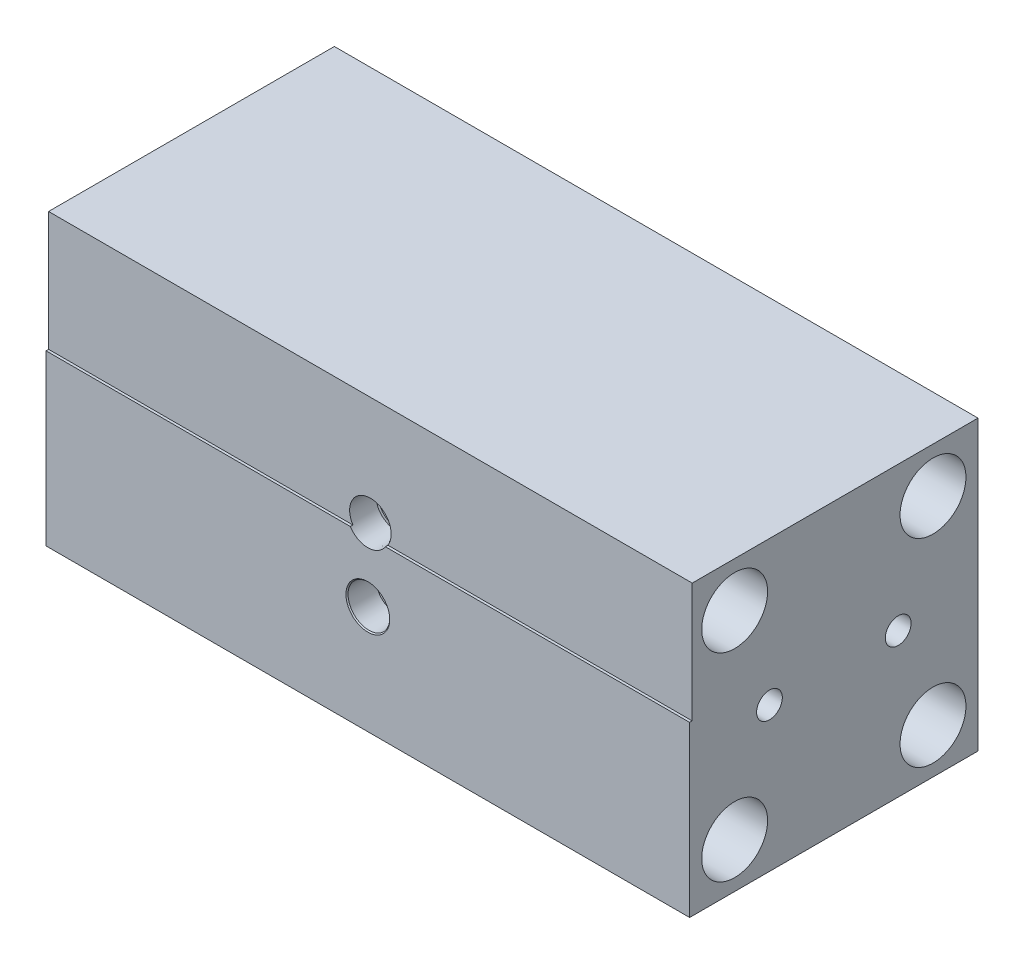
SolidWorks part; units mm, degrees
ref_plane "Front Plane" through (0, 0, 0) normal (0, 0, 1) x (1, 0, 0)
ref_plane "Top Plane" through (0, 0, 0) normal (0, 1, 0) x (1, 0, 0)
ref_plane "Right Plane" through (0, 0, 0) normal (1, 0, 0) x (0, 0, -1)
sketch "Sketch1" plane through (0, 0, 0) normal (0, 0, 1) x (1, 0, 0)
  line L0 (-79.375, -35.56) -> (79.375, -35.56)
  line L1 (79.375, -35.56) -> (79.375, 35.56)
  line L2 (79.375, 35.56) -> (-79.375, 35.56)
  line L3 (-79.375, 35.56) -> (-79.375, -35.56)
  line L4 (-79.375, 35.56) -> (79.375, -35.56) construction
  dimension "D1" = 158.75
  dimension "D2" = 71.12
extrude "Extrude1" add sketch "Sketch1" along normal mid plane 71.12
sketch "Sketch18" plane through (79.375, 0, 0) normal (1, 0, 0) x (0, 0, -1)
  line L0 (-35.56, 35.56) -> (-35.56, 6.1214)
  line L1 (-35.56, 6.1214) -> (-34.925, 6.1214)
  line L2 (-34.925, 6.1214) -> (-34.925, 35.56)
  line L3 (-34.925, 35.56) -> (-35.56, 35.56)
  line L4 (-35.56, 35.56) -> (35.56, 35.56) construction
  line L5 (-35.56, -35.56) -> (-35.56, 35.56) construction
  dimension "D1" = 29.4386
  dimension "D2" = 0.635
  dimension "D3" = 34.925
extrude "Cut-Extrude1" cut sketch "Sketch18" against normal through all
hole_wizard "1/4-20 Tapped Hole1" positions "Sketch20" profile "Sketch19" tap size "1/4-20" standard "ANSI Inch"
sketch "Sketch20" plane through (0.5389, -35.56, 6.9814) normal (0, 1, 0) x (1, 0, 0)
  line L1 (-57.6889, 6.9814) -> (-19.5889, 6.9814) construction
  line L2 (-19.5889, 6.9814) -> (18.5111, 6.9814) construction
  line L3 (18.5111, 6.9814) -> (56.6111, 6.9814) construction
  point P0 (-57.6889, 6.9814)
  point P2 (56.6111, 6.9814)
  point P9 (-19.5889, 6.9814)
  point P11 (18.5111, 6.9814)
  dimension "D1" = 114.3
  dimension "D2" = 38.1
sketch "Sketch19" plane through (-57.15, -35.56, 0) normal (1, 0, 0) x (0, 0, -1)
  line L0 (0, 0) -> (0, 15.834)
  line L1 (0, 15.834) -> (2.5527, 14.3002)
  line L2 (2.5527, 14.3002) -> (2.5527, 0)
  line L5 (2.5527, 0) -> (0, 0)
  line L10 (0, 15.834) -> (-2.5527, 14.3002) construction
  line L11 (0, -6.35) -> (0, 107.95) construction
  dimension "Tap Drill Dia." = 5.1054
  dimension "Tap Drill Depth" = 14.3002
  dimension "Drill Angle" = 118
hole_wizard "Hole1" positions "Sketch22" profile "Sketch21" legacy
sketch "Sketch22" plane through (-46.1336, -35.56, -8.9694) normal (0, 1, 0) x (1, 0, 0)
  line L0 (8.0336, -8.9694) -> (84.2336, -8.9694) construction
  point P0 (8.0336, -8.9694)
  point P2 (84.2336, -8.9694)
  dimension "D1" = 76.2
sketch "Sketch21" plane through (-38.1, -35.56, 0) normal (1, 0, 0) x (0, 0, -1)
  line L0 (0, 0) -> (0, 8.2577)
  line L1 (0, 8.2577) -> (3.175, 6.35)
  line L2 (3.175, 6.35) -> (3.175, 0)
  line L4 (3.175, 0) -> (0, 0)
  line L6 (0, 8.2577) -> (-3.175, 6.35) construction
  line L7 (0, -4.2442) -> (0, 117.3081) construction
  dimension "Diameter" = 6.35
  dimension "Depth" = 6.35
  dimension "Drill Angle" = 118
hole_wizard "1/8 NPT Tapped Hole1" positions "Sketch24" profile "Sketch23" size "1/8" standard "ANSI Inch"
sketch "Sketch24" plane through (0, 0, 35.56) normal (0, 0, 1) x (1, 0, 0)
  line L0 (-79.375, -35.56) -> (79.375, -35.56) construction
  point P0 (0, -8.89)
  point P2 (0, 8.89)
  dimension "D1" = 17.78
  dimension "D4" = 26.67
sketch "Sketch23" plane through (0, -8.89, 35.56) normal (1, 0, 0) x (0, -1, 0)
  line L0 (0, 0) -> (0, 14.1667)
  line L1 (4.2164, 11.6332) -> (0, 14.1667)
  line L2 (-4.2164, 11.6332) -> (0, 14.1667) construction
  line L3 (4.2164, 11.6332) -> (4.2164, 6.9342)
  line L4 (4.2164, 6.9342) -> (4.9362, 6.9342)
  line L5 (4.9362, 6.9342) -> (5.1438, 0)
  line L6 (-4.9362, 6.9342) -> (-5.1438, 0) construction
  line L7 (5.1438, 0) -> (0, 0)
  line L8 (0, -6.35) -> (0, 107.95) construction
  line L11 (-4.2164, 6.9342) -> (-4.9362, 6.9342) construction
  dimension "Tap Drill Dia." = 8.4328
  dimension "Tap Drill Depth" = 11.6332
  dimension "Thread Dia." = 10.2876
  dimension "Thread Angle" = 3.43
  dimension "Thread Depth" = 6.9342
  dimension "Drill Angle" = 118
hole_wizard "1/4-20 Tapped Hole2" positions "Sketch26" profile "Sketch25" tap size "1/4-20" standard "ANSI Inch"
sketch "Sketch26" plane through (0, 0, -35.56) normal (0, 0, -1) x (-1, 0, 0)
  line L0 (-63.5, 10.16) -> (63.5, 10.16) construction
  line L1 (-63.5, 10.16) -> (-63.5, -10.16) construction
  line L2 (-63.5, -10.16) -> (63.5, 10.16) construction
  point P0 (-63.5, 10.16)
  point P2 (63.5, 10.16)
  point P11 (-63.5, -10.16)
  point P13 (63.5, -10.16)
  dimension "D1" = 127
  dimension "D2" = 20.32
sketch "Sketch25" plane through (63.5, 10.16, -35.56) normal (1, 0, 0) x (0, 1, 0)
  line L0 (0, 0) -> (0, 17.4088)
  line L1 (0, 17.4088) -> (2.5527, 15.875)
  line L2 (2.5527, 15.875) -> (2.5527, 0)
  line L5 (2.5527, 0) -> (0, 0)
  line L10 (0, 17.4088) -> (-2.5527, 15.875) construction
  line L11 (0, -6.35) -> (0, 107.95) construction
  dimension "Tap Drill Dia." = 5.1054
  dimension "Tap Drill Depth" = 15.875
  dimension "Drill Angle" = 118
hole_wizard "Hole2" positions "Sketch28" profile "Sketch27" legacy
sketch "Sketch28" plane through (0, 0, -35.56) normal (0, 0, -1) x (-1, 0, 0)
  line L2 (-50.8, -10.16) -> (50.8, 10.16) construction
  point P0 (50.8, 10.16)
  point P2 (-50.8, -10.16)
  dimension "D1" = 101.6
  dimension "D2" = 20.32
sketch "Sketch27" plane through (-50.8, 10.16, -35.56) normal (1, 0, 0) x (0, 1, 0)
  line L0 (0, 0) -> (0, 8.2577)
  line L1 (0, 8.2577) -> (3.175, 6.35)
  line L2 (3.175, 6.35) -> (3.175, 0)
  line L4 (3.175, 0) -> (0, 0)
  line L6 (0, 8.2577) -> (-3.175, 6.35) construction
  line L7 (0, -4.2442) -> (0, 117.3081) construction
  dimension "Diameter" = 6.35
  dimension "Depth" = 6.35
  dimension "Drill Angle" = 118
sketch "Sketch29" plane through (79.375, 0, 0) normal (1, 0, 0) x (0, 0, -1)
  line L0 (-24.4602, 24.4602) -> (24.4602, -24.4602) construction
  line L1 (-15.875, 0) -> (15.875, 0) construction
  circle A0 centre (-24.4602, 24.4602) radius 8.128
  circle A1 centre (24.4602, 24.4602) radius 8.128
  circle A2 centre (-24.4602, -24.4602) radius 8.128
  circle A3 centre (24.4602, -24.4602) radius 8.128
  circle A4 centre (-15.875, 0) radius 3.175
  circle A5 centre (15.875, 0) radius 3.175
  dimension "D1" = 48.9204
  dimension "D2" = 48.9204
  dimension "D3" = 16.256
  dimension "D4" = 6.35
  dimension "D5" = 31.75
extrude "Cut-Extrude2" cut sketch "Sketch29" against normal through all
chamfer "Chamfer1" distance 0.254 angle 45 13 edges at (-66.0527, 10.16, -35.56) (47.625, -10.16, -35.56) (-53.975, 10.16, -35.56) (60.9473, 10.16, -35.56) (5.1438, -8.89, 35.56) (-66.0527, -10.16, -35.56) (60.9473, -10.16, -35.56) (57.15, -35.56, -2.5527) (38.1, -35.56, -3.175) (19.05, -35.56, -2.5527) (-19.05, -35.56, -2.5527) (-38.1, -35.56, -3.175) (-57.15, -35.56, -2.5527)
